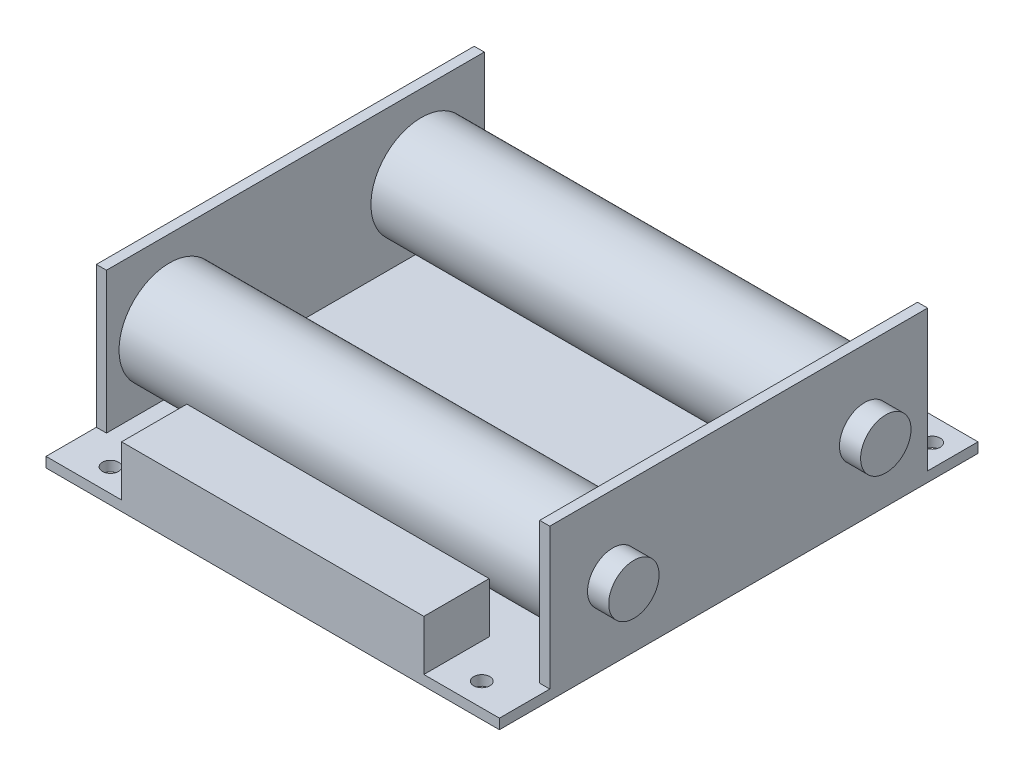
SolidWorks part; units mm, degrees
ref_plane "Front Plane" through (0, 0, 0) normal (0, 0, 1) x (1, 0, 0)
ref_plane "Top Plane" through (0, 0, 0) normal (0, 1, 0) x (1, 0, 0)
ref_plane "Right Plane" through (0, 0, 0) normal (1, 0, 0) x (0, 0, -1)
sketch "Sketch1" plane through (0, 0, 0) normal (0, 1, 0) x (1, 0, 0)
  line L1 (45, 47.5) -> (-45, 47.5)
  line L2 (45, 47.5) -> (45, -47.5)
  line L3 (45, -47.5) -> (-45, -47.5)
  line L4 (-45, 47.5) -> (-45, -47.5)
  line L5 (45, 47.5) -> (-45, -47.5) construction
  line L6 (45, -47.5) -> (-45, 47.5) construction
  point P0 (0, 0)
  dimension "D1" = 90
  dimension "D2" = 95
extrude "Boss-Extrude1" add sketch "Sketch1" along normal blind 2
hole_wizard "Ø3.2 (3.2) Diameter Hole1" positions "Sketch3" profile "Sketch2" hole size "Ø3.2" standard "ISO"
sketch "Sketch3" plane through (0, 0, 0) normal (0, -1, 0) x (-1, 0, 0)
  line L0 (45, 47.5) -> (45, -47.5) construction
  line L2 (45, -47.5) -> (-45, -47.5) construction
  line L3 (-45, -47.5) -> (-45, 47.5) construction
  line L4 (-45, 47.5) -> (45, 47.5) construction
  point P0 (36.8, -42.9)
  point P2 (-36.9, -42.9)
  point P4 (-40.6, 42.8)
  point P6 (39.4, 42.8)
  dimension "D1" = 8.2
  dimension "D2" = 4.6
  dimension "D3" = 8.1
  dimension "D4" = 4.6
  dimension "D5" = 4.7
  dimension "D6" = 4.4
  dimension "D7" = 4.7
  dimension "D8" = 5.6
sketch "Sketch2" plane through (-36.8, 0, 42.9) normal (1, 0, 0) x (0, 0, -1)
  line L0 (0, 0) -> (0, 2)
  line L1 (0, 2) -> (1.6, 2)
  line L2 (1.6, 2) -> (1.6, 0)
  line L5 (1.6, 0) -> (0, 0)
  line L11 (0, -6.35) -> (0, 107.95) construction
  dimension "Thru Hole Dia." = 3.2
  dimension "Thru Hole Depth" = 2
sketch "Sketch4" plane through (45, 0, 0) normal (1, 0, 0) x (0, 0, -1)
  line L0 (-47.5, 0) -> (47.5, 0) construction
  line L1 (-37.5, 0) -> (37.5, 0)
  line L2 (-37.5, 0) -> (-37.5, 30)
  line L3 (-37.5, 30) -> (37.5, 30)
  line L4 (37.5, 0) -> (37.5, 30)
  line L5 (-47.5, 2) -> (-47.5, 0) construction
  line L6 (47.5, 2) -> (47.5, 0) construction
  point P6 (-47.5, 1)
  dimension "D1" = 10
  dimension "D2" = 10
  dimension "D3" = 30
extrude "Boss-Extrude2" add sketch "Sketch4" against normal blind 2
mirror "Mirror1" about plane through (0, 0, 0) normal (1, 0, 0) of "Boss-Extrude2"
sketch "Sketch5" plane through (45, 0, 0) normal (1, 0, 0) x (0, 0, -1)
  line L0 (47.5, 2) -> (47.5, 0) construction
  line L2 (37.5, 30) -> (-37.5, 30) construction
  circle A0 centre (-25, 15) radius 5
  circle A1 centre (25, 15) radius 5
  point P4 (47.5, 1)
  dimension "D1" = 10
  dimension "D2" = 10
  dimension "D3" = 50
  dimension "D4" = 22.5
  dimension "D5" = 15
extrude "Boss-Extrude3" add sketch "Sketch5" along normal blind 4.2 and the other way blind 94.2
surface "Surface-Offset1" parameters "D1"=5
sketch "Sketch6" plane through (0, 2, 0) normal (0, 1, 0) x (1, 0, 0)
  line L0 (-45, -47.5) -> (45, -47.5) construction
  line L1 (-30, -34.5) -> (30, -34.5)
  line L2 (-30, -34.5) -> (-30, -47.5)
  line L3 (-30, -47.5) -> (30, -47.5)
  line L4 (30, -34.5) -> (30, -47.5)
  line L5 (-45, -37.5) -> (-45, -47.5) construction
  line L6 (45, -47.5) -> (45, -37.5) construction
  dimension "D1" = 15
  dimension "D2" = 15
  dimension "D3" = 13
extrude "Boss-Extrude4" add sketch "Sketch6" along normal blind 10
